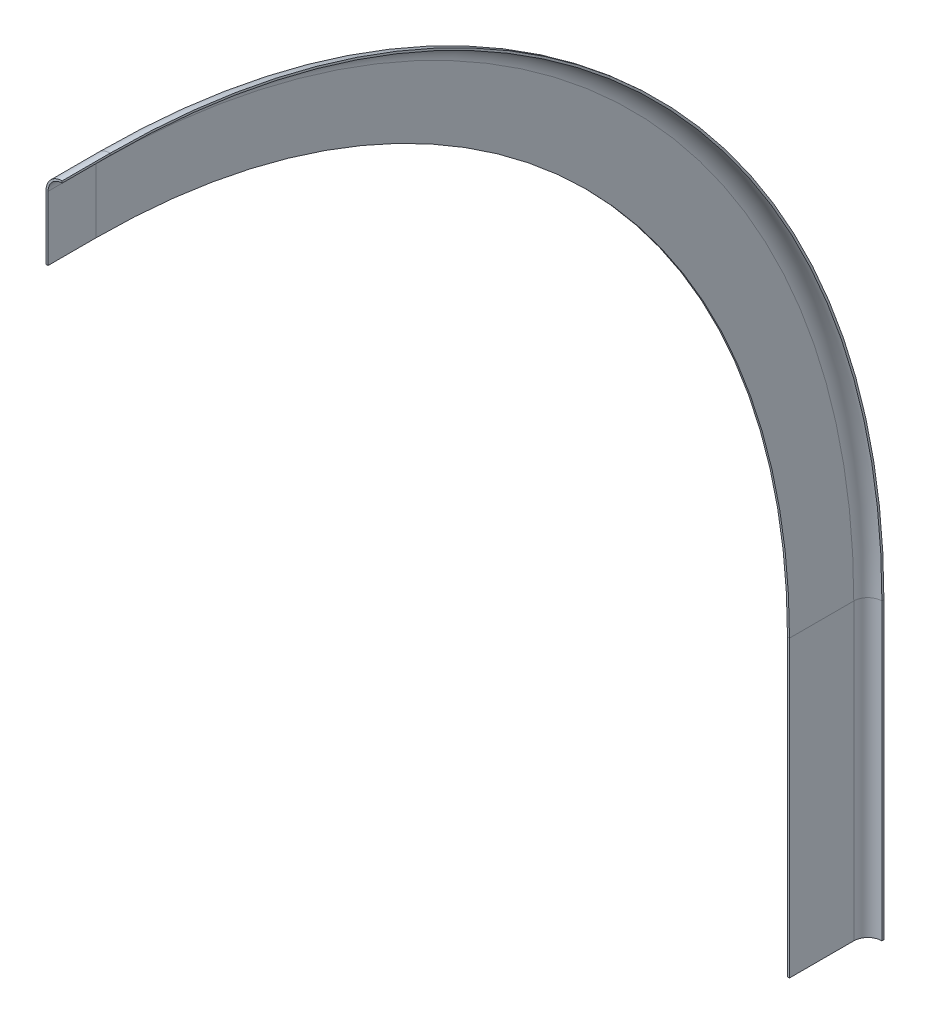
SolidWorks part; units mm, degrees
ref_plane "Front Plane" through (0, 0, 0) normal (1, 0, 0) x (0, 1, 0)
ref_plane "Top Plane" through (0, 0, 0) normal (0, 0, 1) x (0, 1, 0)
ref_plane "Right Plane" through (0, 0, 0) normal (0, 1, 0) x (-1, 0, 0)
sketch "sk 47.8in radi" plane through (0, 0, 0) normal (1, 0, 0) x (0, 1, 0)
  line B0 (-844.7111, -650.1) -> (-379.5689, -650.1)
  line B1 (-844.7111, -648.5125) -> (-379.5689, -648.5125)
  line B2 (844.7111, 574.18) -> (844.7111, 650.1)
  line B3 (843.1236, 574.18) -> (843.1236, 650.1)
  line B4 (843.1236, 650.1) -> (844.7111, 650.1)
  line B5 (-844.7111, -648.5125) -> (-844.7111, -650.1)
  arc B6 (-379.5689, -650.1) -> (844.7111, 574.18) centre (-379.5689, 574.18) ccw
  arc B7 (-379.5689, -648.5125) -> (843.1236, 574.18) centre (-379.5689, 574.18) ccw
  dimension "D1" = 650.1
  dimension "D2" = 844.7111
sketch_block_instance "Block1-1"
sketch_block "Block1" parameters "D1"=1224.28, "D2"=1222.6925, "D4"=1215.2, "D5"=1213.6125, "D3"=1.5875, "D6"=85, "D7"=474.2222
sketch "Curve Path" plane through (0, 0, 0) normal (1, 0, 0) x (0, 1, 0)
  line L0 (-844.7111, -648.5125) -> (-379.5689, -648.5125)
  line L1 (843.1236, 574.18) -> (843.1236, 650.1)
  arc A0 (843.1236, 574.18) -> (-379.5689, -648.5125) centre (-379.5689, 574.18) cw
  arc A1 (-379.5689, -648.5125) -> (843.1236, 574.18) centre (-379.5689, 574.18) ccw construction
ref_plane "Plane Body" through (0, -844.7111, 0) normal (0, 1, 0) x (-1, 0, 0)
sketch "Sketch5"
sketch_block_instance "Block3-3"
sketch_block "Block3" parameters "D1"=25.4, "D2"=16.51, "D3"=61.595, "D4"=243.65
sketch "Body" plane through (0, -844.7111, 0) normal (0, 1, 0) x (-1, 0, 0)
  line L0 (0, -648.5125) -> (92.71, -648.5125) construction
  line L1 (118.11, -623.1125) -> (118.11, -521.5125)
  line L2 (14.605, -398.5125) -> (92.71, -398.5125) construction
  line L3 (0, -645.3375) -> (92.71, -645.3375) construction
  line L4 (114.935, -623.1125) -> (114.935, -521.5125)
  line L5 (14.605, -401.6875) -> (92.71, -401.6875) construction
  line L6 (0, -645.3375) -> (0, -648.5125) construction
  line L7 (14.605, -398.5125) -> (14.605, -401.6875) construction
  line L8 (92.71, -645.3375) -> (92.71, -648.5125)
  line L9 (114.935, -521.5125) -> (118.11, -521.5125)
  line L10 (118.11, -623.1125) -> (118.11, -423.9125) construction
  line L11 (114.935, -623.1125) -> (114.935, -423.9125) construction
  line L12 (114.935, -423.9125) -> (114.935, -521.5125) construction
  line L13 (118.11, -423.9125) -> (118.11, -521.5125) construction
  arc A0 (118.11, -423.9125) -> (92.71, -398.5125) centre (92.71, -423.9125) ccw construction
  arc A1 (118.11, -423.9125) -> (92.71, -398.5125) centre (92.71, -423.9125) ccw construction
  arc A2 (92.71, -648.5125) -> (118.11, -623.1125) centre (92.71, -623.1125) ccw
  arc A3 (92.71, -648.5125) -> (118.11, -623.1125) centre (92.71, -623.1125) ccw construction
  arc A4 (92.71, -645.3375) -> (114.935, -623.1125) centre (92.71, -623.1125) ccw
  arc A5 (114.935, -423.9125) -> (92.71, -401.6875) centre (92.71, -423.9125) ccw construction
  dimension "D2" = 101.6
  dimension "D1" = 3.175
sweep "Sweep1" add profiles "Body" path "Curve Path"
